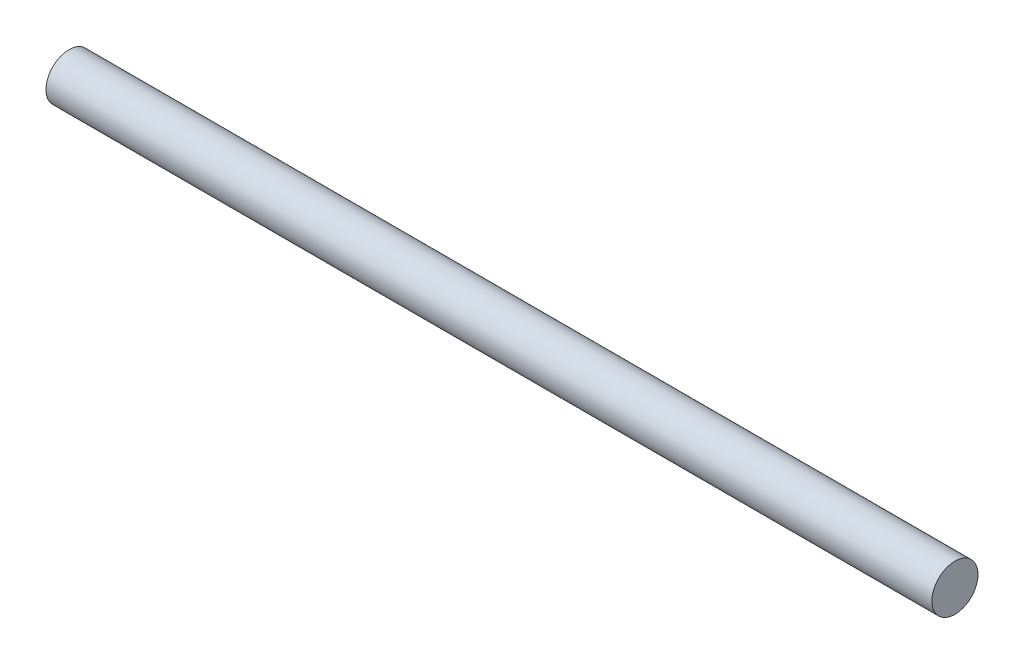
SolidWorks part; units mm, degrees
ref_plane "Front Plane" through (0, 0, 0) normal (0, 0, 1) x (1, 0, 0)
ref_plane "Top Plane" through (0, 0, 0) normal (0, 1, 0) x (1, 0, 0)
ref_plane "Right Plane" through (0, 0, 0) normal (1, 0, 0) x (0, 0, -1)
sketch "Sketch1" plane through (0, 0, 0) normal (1, 0, 0) x (0, 0, -1)
  circle A0 centre (0, 0) radius 2.5
  dimension "D1" = 5
extrude "Boss-Extrude1" add sketch "Sketch1" along normal mid plane 96 contours A0
